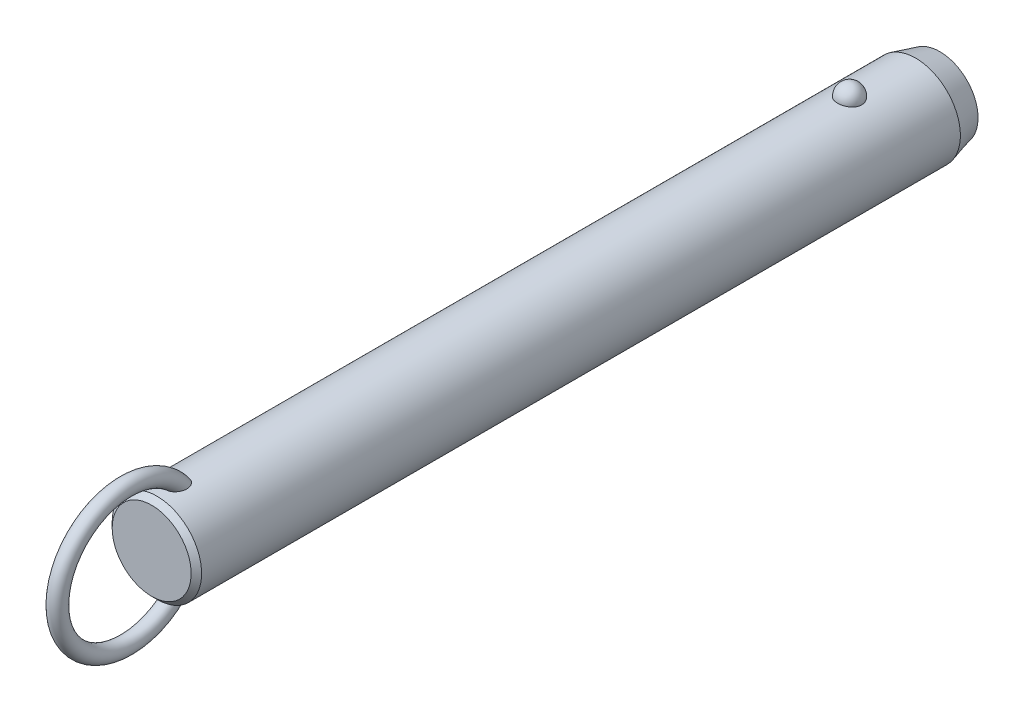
SolidWorks part; units mm, degrees
ref_plane "Front Plane" through (0, 0, 0) normal (0, 0, 1) x (1, 0, 0)
ref_plane "Top Plane" through (0, 0, 0) normal (0, 1, 0) x (1, 0, 0)
ref_plane "Right Plane" through (0, 0, 0) normal (1, 0, 0) x (0, 0, -1)
sketch "Sketch2" plane through (0, 0, 0) normal (0, 0, 1) x (1, 0, 0)
  circle A0 centre (0, 0) radius 11.1
  point P3 (0, 11.1)
  dimension "D1" = 22.2
extrude "Boss-Extrude1" add sketch "Sketch2" along normal blind 157.5
sketch "Sketch3" plane through (0, 0, 0) normal (0, 0, -1) x (-1, 0, 0)
  circle A0 centre (0, 0) radius 11.1
  dimension "D1" = 22.2
extrude "Boss-Extrude2" add sketch "Sketch3" along normal blind 25.4
chamfer "Chamfer1" distance 6 angle 15 1 edges at (-11.1, 0, -25.4)
sketch "Sketch12" plane through (0, 0, 0) normal (1, 0, 0) x (0, 0, -1)
  line L0 (-157.5, 11.1) -> (-157.5, -11.1) construction
  point P0 (-157.5, 0)
sketch "Sketch13" plane through (0, 0, 0) normal (1, 0, 0) x (0, 0, -1)
  circle A0 centre (-176.55, 0) radius 19.05
  point P2 (-157.5, 0)
  dimension "D1" = 38.1
sketch "Sketch14" plane through (0, 0, 0) normal (0, 1, 0) x (1, 0, 0)
  circle A0 centre (0, -159.5) radius 2
  point P2 (0, -157.5)
  dimension "D1" = 4
sweep "Sweep1" add profiles "Sketch14" path "Sketch13"
sketch "Sketch15" plane through (0, 0, 157.5) normal (0, 0, 1) x (1, 0, 0)
  circle A0 centre (0, 0) radius 11.1
  dimension "D1" = 22.2
extrude "Boss-Extrude3" add sketch "Sketch15" along normal blind 12.7
chamfer "Chamfer2" distance 1.3 angle 45 1 edges at (11.1, 0, 170.2)
sketch "Sketch18" plane through (0, 0, 0) normal (1, 0, 0) x (0, 0, -1)
  line L0 (19.4, 11.1) -> (-161.068, 11.1) construction
  line L1 (3, 14.1) -> (3, 8.1)
  line L2 (-161.068, -11.1) -> (19.4, -11.1) construction
  arc A0 (3, 14.1) -> (3, 8.1) centre (3, 11.1) ccw
  point P4 (0, 11.1)
  dimension "D1" = 25.2
revolve "Revolve1" add sketch "Sketch18" angle 360 about L1
